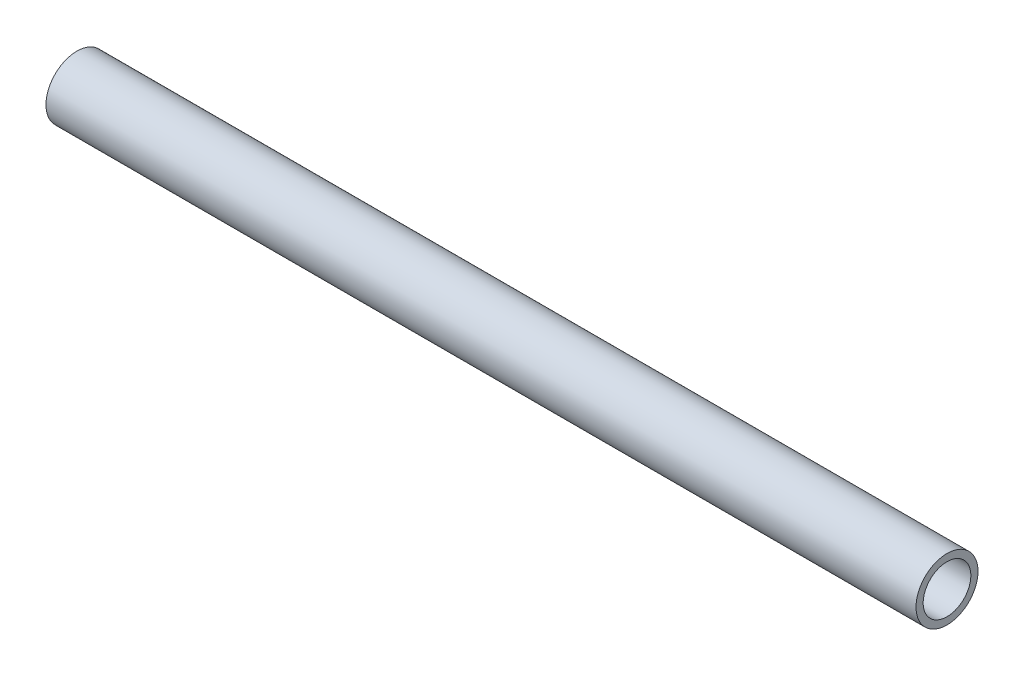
SolidWorks part; units mm, degrees
ref_plane "Front" through (0, 0, 0) normal (0, 0, 1) x (1, 0, 0)
ref_plane "Top" through (0, 0, 0) normal (0, 1, 0) x (1, 0, 0)
ref_plane "Right" through (0, 0, 0) normal (1, 0, 0) x (0, 0, -1)
sketch "Sketch1" plane through (0, 0, 0) normal (0, 0, 1) x (1, 0, 0)
  line L0 (0, 0) -> (463.55, 0)
  line L1 (9.9848, 0) -> (-9.9848, 0) construction
  dimension "D1" = 463.55
other "Structural Member1"
ref_plane "Plane1" through (0, 0, 0) normal (1, 0, 0) x (0, 0, -1)
sketch "Sketch11" plane through (0, 0, 0) normal (1, 0, 0) x (0, 0, -1)
  circle A0 centre (0, 0) radius 12.7
  circle A1 centre (0, 0) radius 16.51
  point P3 (0, 0)
  dimension "D1" = 33.02
  dimension "D2" = 25.4
